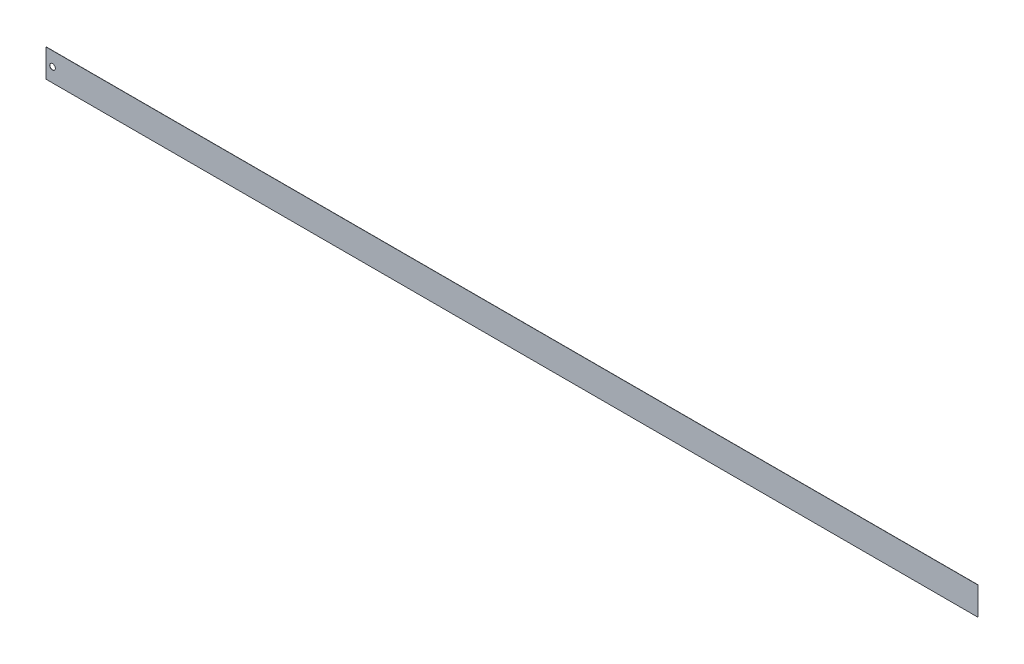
SolidWorks part; units mm, degrees
ref_plane "Front Plane" through (0, 0, 0) normal (0, 0, 1) x (1, 0, 0)
ref_plane "Top Plane" through (0, 0, 0) normal (0, 1, 0) x (1, 0, 0)
ref_plane "Right Plane" through (0, 0, 0) normal (1, 0, 0) x (0, 0, -1)
sketch "Sketch1" plane through (0, 0, 0) normal (0, 0, 1) x (1, 0, 0)
  line L1 (-71.5184, 24.1198) -> (428.4816, 24.1198)
  line L2 (-71.5184, 24.1198) -> (-71.5184, 9.1198)
  line L3 (-71.5184, 9.1198) -> (428.4816, 9.1198)
  line L4 (428.4816, 24.1198) -> (428.4816, 9.1198)
  circle A0 centre (-68.0184, 16.6198) radius 1.5
extrude "Boss-Extrude3" add sketch "Sketch1" along normal blind 0.1
